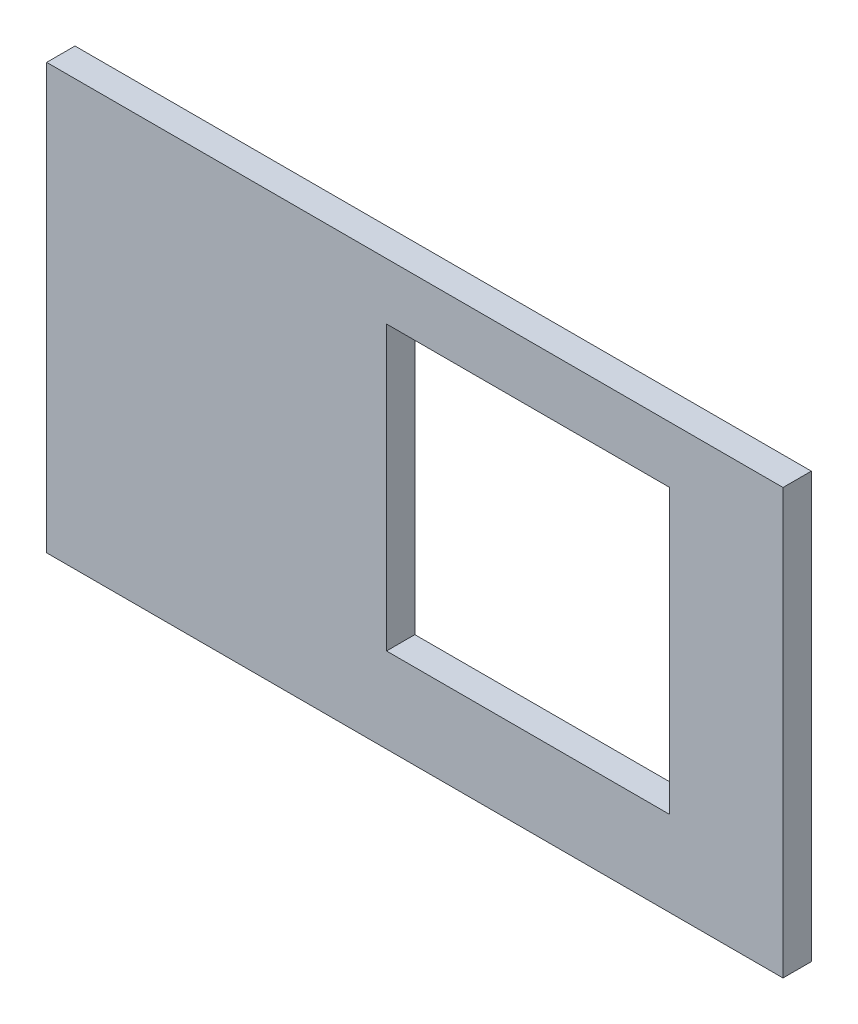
SolidWorks part; units mm, degrees
extrude "Base-Extrusion" add sketch "Esquisse1" along normal blind 2
sketch "Esquisse1" plane through (0, 0, 0) normal (0, 0, 1) x (1, 0, 0)
  line L1 (0, 0) -> (52, 0)
  line L2 (0, 0) -> (0, 30)
  line L3 (0, 30) -> (52, 30)
  line L4 (52, 0) -> (52, 30)
  line L5 (24, 26) -> (44, 26)
  line L6 (24, 26) -> (24, 6)
  line L7 (24, 6) -> (44, 6)
  line L8 (44, 26) -> (44, 6)
  dimension "D1" = 52
  dimension "D2" = 20
  dimension "D3" = 20
  dimension "D4" = 4
  dimension "D5" = 24
  dimension "D6" = 30
ref_plane "Plan1" through (0, 0, 0) normal (0, 0, 1) x (1, 0, 0)
ref_plane "Plan2" through (0, 0, 0) normal (0, 1, 0) x (1, 0, 0)
ref_plane "Plan3" through (0, 0, 0) normal (1, 0, 0) x (0, 0, -1)
